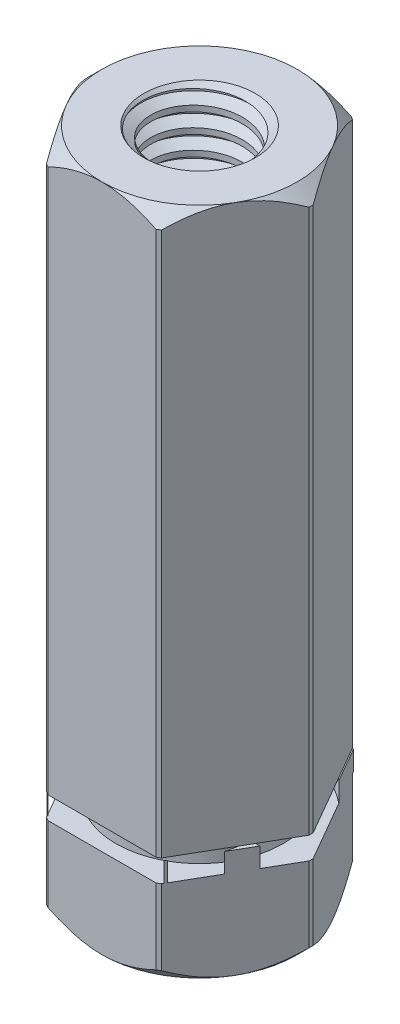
SolidWorks part; units mm, degrees
ref_plane "Front Plane" through (0, 0, 0) normal (0, 0, 1) x (1, 0, 0)
ref_plane "Top Plane" through (0, 0, 0) normal (0, 1, 0) x (1, 0, 0)
ref_plane "Right Plane" through (0, 0, 0) normal (1, 0, 0) x (0, 0, -1)
imported_body "Imported1"
sketch "Sketch1" plane through (0, 0, 0) normal (0, 1, 0) x (1, 0, 0)
  line L0 (0, 3.5) -> (-1.9365, 3.5) construction
  line L1 (2.0207, 3.5) -> (-2.0207, 3.5)
  line L2 (-2.0207, 3.5) -> (-4.0415, 0)
  line L3 (-4.0415, 0) -> (-2.0207, -3.5)
  line L4 (-2.0207, -3.5) -> (2.0207, -3.5)
  line L5 (2.0207, -3.5) -> (4.0415, 0)
  line L6 (4.0415, 0) -> (2.0207, 3.5)
  circle A0 centre (0, 0) radius 3.5 construction
  circle A1 centre (0, 0) radius 7.2771
extrude "Cut-Extrude1" cut sketch "Sketch1" along normal up to surface (3.9 mm away)
